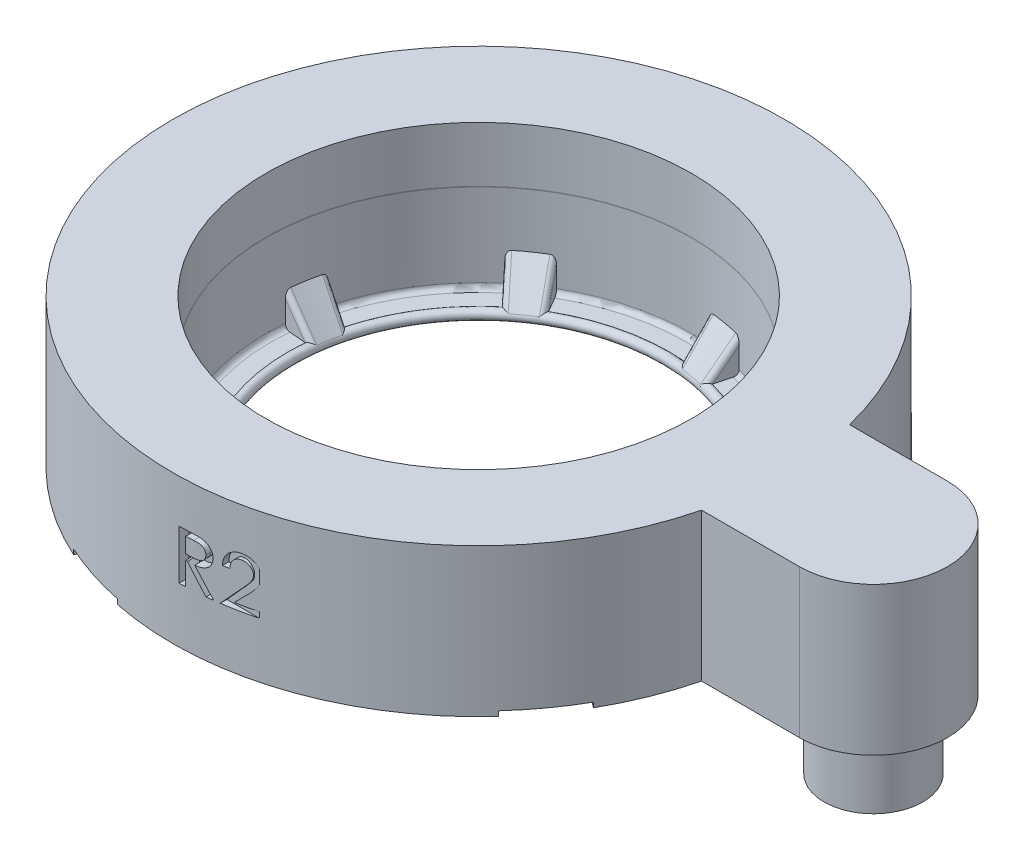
SolidWorks part; units mm, degrees
ref_plane "Front Plane" through (0, 0, 0) normal (0, 0, 1) x (1, 0, 0)
ref_plane "Top Plane" through (0, 0, 0) normal (0, 1, 0) x (1, 0, 0)
ref_plane "Right Plane" through (0, 0, 0) normal (1, 0, 0) x (0, 0, -1)
sketch "Sketch1" plane through (0, 0, 0) normal (0, 0, 1) x (1, 0, 0)
  line L4 (67.5544, -14.2748) -> (78.74, -14.2748)
  line L5 (78.74, -14.2748) -> (78.74, 23.8252)
  line L6 (78.74, 23.8252) -> (54.737, 23.8252)
  line L8 (0, 0) -> (0, 61.9172) construction
  line L9 (54.737, -2.54) -> (42.5996, -11.4289)
  line L11 (54.737, 23.8252) -> (54.737, -2.54)
  line L13 (67.5544, -14.2748) -> (58.9219, -16.7459)
  line L15 (-69.2609, -14.2748) -> (69.2609, -14.2748) construction
  line L16 (42.5996, -11.4289) -> (42.5996, -16.7459)
  line L17 (42.5996, -16.7459) -> (58.9219, -16.7459)
  dimension "D5" = 117.8438
  dimension "D1" = 157.48
  dimension "D2" = 109.474
  dimension "D3" = 135.1087
  dimension "D4" = 85.1993
  dimension "D6" = 38.1
  dimension "D7" = 2.4711
  dimension "D8" = 11.4289
  dimension "D9" = 2.54
revolve "Revolve1" add sketch "Sketch1" angle 360 about L8
other "Cavity1"
other "FAN grommet 2<1>@Vent fan mold1"
sketch "Sketch2" plane through (0, 0, 0) normal (0, 1, 0) x (1, 0, 0)
  line L0 (0, 0) -> (150.4333, 0) construction
  line L1 (101.6, 19.05) -> (76.4008, 19.05)
  line L2 (101.6, -19.05) -> (76.4008, -19.05)
  line L3 (76.4008, -19.05) -> (76.4008, 19.05)
  arc A0 (101.6, -19.05) -> (101.6, 19.05) centre (101.6, 0) ccw
  circle A1 centre (0, 0) radius 78.74 construction
  dimension "D1" = 38.1
  dimension "D2" = 101.6
extrude "Boss-Extrude1" add sketch "Sketch2" along normal up to surface and the other way up to surface
sketch "Sketch3" plane through (0, -14.2748, 0) normal (0, -1, 0) x (1, 0, 0)
  circle A0 centre (101.6, 0) radius 9.525
  dimension "D1" = 19.05
sketch "Sketch4" plane through (0, 0, 0) normal (0, 0, 1) x (1, 0, 0)
  line L0 (0, 0) -> (87.3252, 0)
  line L1 (76.4008, -14.2748) -> (101.6, -14.2748) construction
  arc A0 (101.6, -14.2748) -> (87.3252, 0) centre (87.3252, -14.2748) ccw
sweep "Cut-Sweep1" cut profiles "Sketch3" path "Sketch4"
sketch "Sketch5" plane through (0, -14.2748, 0) normal (0, -1, 0) x (1, 0, 0)
  circle A0 centre (101.6, 0) radius 9.525
  circle A2 centre (101.6, 0) radius 9.525 construction
  circle A3 centre (101.6, 0) radius 12.7
  dimension "D1" = 25.4
extrude "Boss-Extrude2" add sketch "Sketch5" along normal blind 17.526
sketch "Sketch6" plane through (0, 0, 0) normal (0, 0, 1) x (1, 0, 0)
  line L1 (-78.74, -14.2748) -> (-73.66, -14.2748)
  line L2 (-78.74, -14.2748) -> (-78.74, -13.0048)
  line L3 (-78.74, -13.0048) -> (-73.66, -13.0048)
  line L4 (-73.66, -14.2748) -> (-73.66, -13.0048)
  dimension "D1" = 1.27
  dimension "D2" = 5.08
extrude "Cut-Extrude1" cut sketch "Sketch6" against normal mid plane 17.526
pattern_circular "CirPattern1" count 5 over 360 about axis through (0, 0, 0) along (0, 1, 0) of "Cut-Extrude1"
ref_plane "Plane1" through (0, 0, 81.28) normal (0, 0, 1) x (1, 0, 0)
sketch "Sketch7" plane through (0, 0, 81.28) normal (0, 0, 1) x (1, 0, 0)
  text T0 "<b>R2</b>" font "Century Gothic" height in points 48
extrude "Cut-Extrude2" cut sketch "Sketch7" against normal blind 5.08
